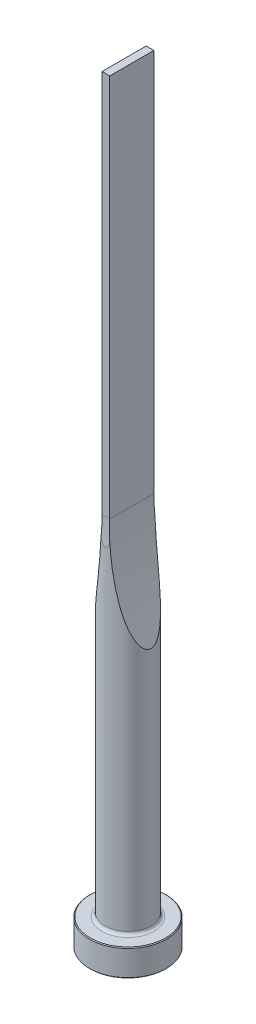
SolidWorks part; units mm, degrees
ref_plane "Front Plane" through (0, 0, 0) normal (0, 0, 1) x (1, 0, 0)
ref_plane "Top Plane" through (0, 0, 0) normal (0, 1, 0) x (1, 0, 0)
ref_plane "Right Plane" through (0, 0, 0) normal (1, 0, 0) x (0, 0, -1)
sketch "Sketch1" plane through (0, 0, 0) normal (0, 0, 1) x (1, 0, 0)
  line L0 (0, 0) -> (9.8, 0)
  line L1 (55, 0) -> (-55, 0) construction
  line L2 (10, 0.2) -> (10, 6.8)
  line L3 (9.8, 7) -> (6.8, 7)
  line L4 (6, 7.8) -> (6, 200)
  line L5 (0, 200) -> (6, 200)
  line L6 (10, 6.8) -> (9.8, 7)
  line L7 (9.8, 0) -> (10, 0.2)
  line L8 (0, 200) -> (0, 0)
  arc A0 (6, 7.8) -> (6.8, 7) centre (6.8, 7.8) ccw
  point P1 (10, 0)
  point P6 (10, 7)
  dimension "D4" = 0.8
  dimension "D1" = 6
  dimension "D2" = 10
  dimension "D3" = 7
  dimension "D5" = 200
revolve "Revolve1" add sketch "Sketch1" angle 360 about L8
sketch "Sketch2" plane through (0, 0, 0) normal (0, 0, 1) x (1, 0, 0)
  line L0 (1, 200) -> (1, 100)
  line L1 (6, 200) -> (-6, 200) construction
  line L2 (-1, 200) -> (-1, 100)
  line L3 (6, 200) -> (6, 70.4196)
  line L4 (-6, 200) -> (-6, 70.4196)
  line L5 (0, -11) -> (0, 11) construction
  line L6 (6, 200) -> (1, 200)
  line L8 (-1, 200) -> (-6, 200)
  arc A0 (1, 100) -> (6, 70.4196) centre (91, 100) ccw
  arc A1 (-1, 100) -> (-6, 70.4196) centre (-91, 100) cw
  dimension "D4" = 90
  dimension "D1" = 100
  dimension "D2" = 2
  dimension "D3" = 1
extrude "Cut-Extrude1" cut sketch "Sketch2" against normal mid plane 15
sketch "Sketch3" plane through (0, 0, 0) normal (1, 0, 0) x (0, 0, -1)
  line L0 (5.75, 200) -> (5.75, 100)
  line L1 (-5.9161, 200) -> (5.9161, 200) construction
  line L2 (-5.75, 200) -> (-5.75, 100)
  line L3 (6, 200) -> (6, 93.2965)
  line L4 (5.75, 200) -> (6, 200)
  line L5 (0, 11) -> (0, -11) construction
  line L6 (-6, 200) -> (-6, 93.2965)
  line L8 (-5.75, 200) -> (-6, 200)
  arc A0 (5.75, 100) -> (6, 93.2965) centre (95.75, 100) ccw
  arc A1 (-5.75, 100) -> (-6, 93.2965) centre (-95.75, 100) cw
  dimension "D2" = 90
  dimension "D1" = 100
  dimension "D3" = 11.5
  dimension "D4" = 5.75
extrude "Cut-Extrude2" cut sketch "Sketch3" against normal mid plane 15
